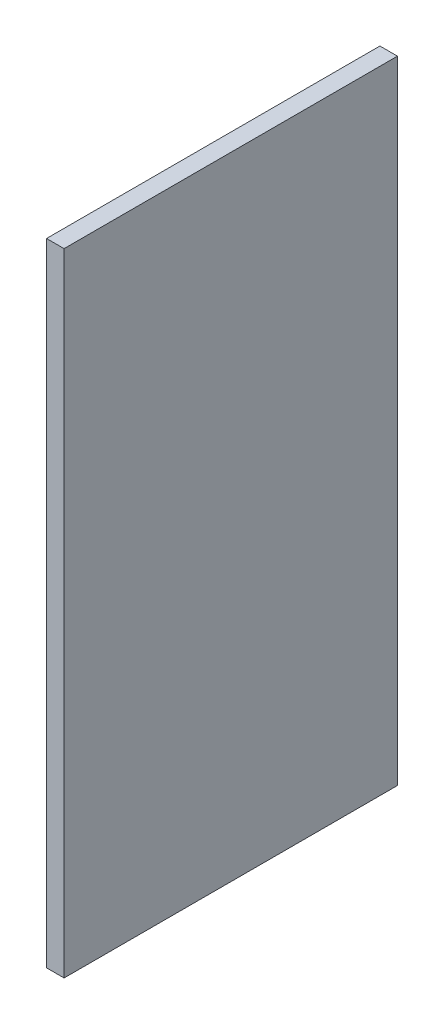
SolidWorks part; units mm, degrees
ref_plane "Front Plane" through (0, 0, 0) normal (1, 0, 0) x (0, 1, 0)
ref_plane "Top Plane" through (0, 0, 0) normal (0, 0, 1) x (0, 1, 0)
ref_plane "Right Plane" through (0, 0, 0) normal (0, 1, 0) x (-1, 0, 0)
sketch "Sketch1" plane through (0, 0, 0) normal (1, 0, 0) x (0, 1, 0)
  line L1 (0, 0) -> (914.4, 0)
  line L2 (0, 0) -> (0, 482.6)
  line L3 (0, 482.6) -> (914.4, 482.6)
  line L4 (914.4, 0) -> (914.4, 482.6)
  dimension "D1" = 914.4
  dimension "D2" = 482.6
extrude "Boss-Extrude1" add sketch "Sketch1" along normal blind 25.4
